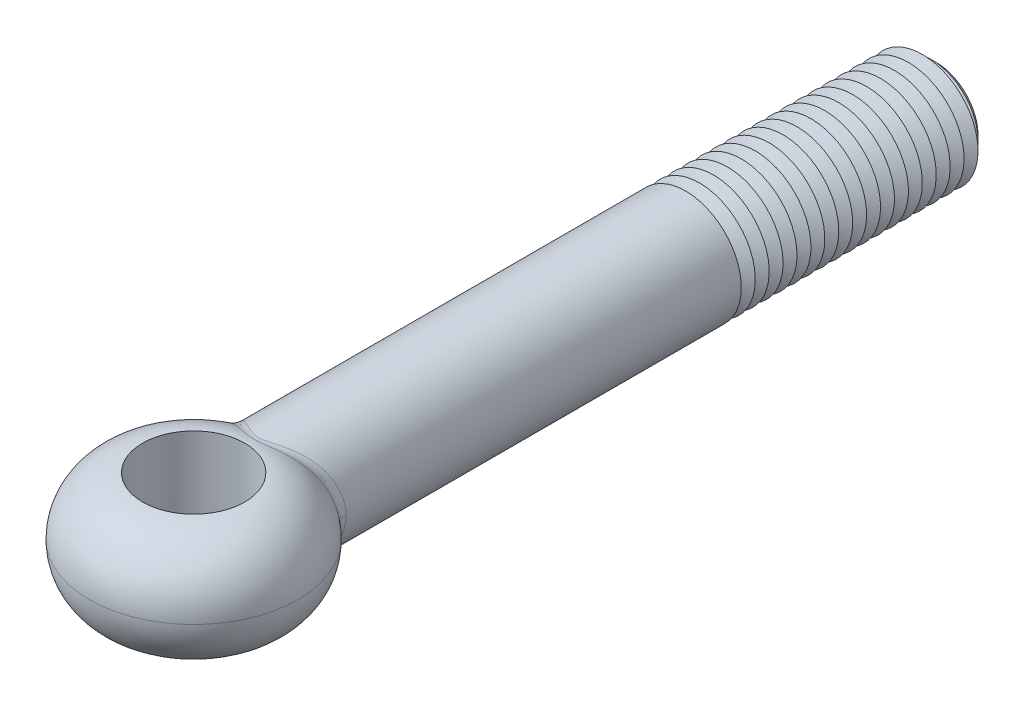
SolidWorks part; units mm, degrees
ref_plane "Front Plane" through (0, 0, 0) normal (0, 0, 1) x (1, 0, 0)
ref_plane "Top Plane" through (0, 0, 0) normal (0, 1, 0) x (1, 0, 0)
ref_plane "Right Plane" through (0, 0, 0) normal (1, 0, 0) x (0, 0, -1)
sketch "Sketch7" plane through (0, 0, 0) normal (0, 1, 0) x (1, 0, 0)
  circle A0 centre (0, 0) radius 22.5
  dimension "D1" = 45
extrude "Boss-Extrude3" add sketch "Sketch7" along normal mid plane 25
sketch "Sketch8" plane through (0, 0, 0) normal (0, 0, 1) x (1, 0, 0)
  circle A0 centre (0, 0) radius 12
  dimension "D1" = 24
extrude "Boss-Extrude4" add sketch "Sketch8" against normal blind 160
fillet "Fillet5" radius 12.5 2 edges at (0, -12.5, 22.5) (0, 12.5, 22.5)
fillet "Fillet6" radius 3.5 2 edges at (0.1915, -11.9985, -13.5039) (-0.1915, 11.9985, -13.5039)
chamfer "Chamfer1" distance 3 angle 45 1 edges at (12, 0, -160)
sketch "Sketch10" plane through (0, 0, 0) normal (0, 1, 0) x (1, 0, 0)
  line L0 (0, 28.1405) -> (0, -7.9233) construction
sketch "Sketch11" plane through (0, 0, 0) normal (0, 1, 0) x (1, 0, 0)
  line L0 (-12, 106) -> (-9.4019, 107.5)
  line L1 (-12, 157) -> (-12, 20.8746) construction
  line L2 (-9.4019, 107.5) -> (-12, 109)
  line L3 (-12, 109) -> (-12, 106)
  line L4 (9, 160) -> (-9, 160) construction
  dimension "D1" = 3
  dimension "D2" = 54
revolve "Cut-Revolve1" cut sketch "Sketch11" angle 360 about L0
pattern_linear "LPattern1" count 18 spacing 3 along (0, 0, -1) of "Cut-Revolve1"
sketch "Sketch12" plane through (0, 0, 0) normal (0, 1, 0) x (1, 0, 0)
  circle A0 centre (0, 0) radius 11
  dimension "D1" = 22
extrude "Cut-Extrude1" cut sketch "Sketch12" against normal mid plane 25
